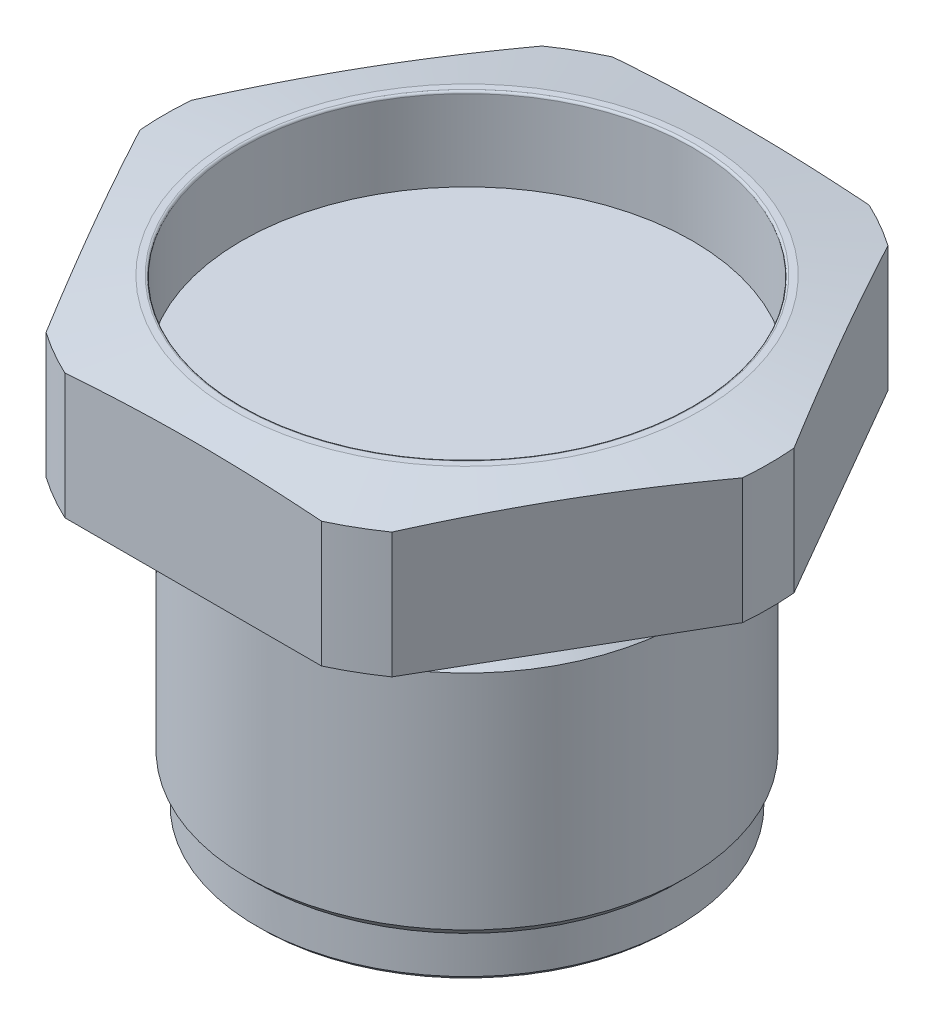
SolidWorks part; units mm, degrees
ref_plane "Front Plane" through (0, 0, 0) normal (0, 0, 1) x (1, 0, 0)
ref_plane "Top Plane" through (0, 0, 0) normal (0, 1, 0) x (1, 0, 0)
ref_plane "Right Plane" through (0, 0, 0) normal (1, 0, 0) x (0, 0, -1)
sketch "Sketch6" plane through (0, 0, 0) normal (0, 0, 1) x (1, 0, 0)
  line L0 (0, -8.9689) -> (0, 71.3762) construction
  line L1 (26.035, 15.875) -> (27.051, 15.875)
  line L2 (27.051, 15.875) -> (34.925, 14.4866)
  line L3 (34.925, 14.4866) -> (34.925, 0)
  line L4 (34.925, 0) -> (24.257, 0)
  line L5 (24.257, 0) -> (24.257, -37.6428)
  line L6 (24.257, -37.6428) -> (0, -37.6428)
  line L7 (0, -37.6428) -> (0, 6.2992)
  line L8 (26.035, 15.875) -> (26.035, 6.2992)
  line L9 (26.035, 6.2992) -> (0, 6.2992)
  dimension "D1" = 48.514
  dimension "D2" = 15.875
  dimension "D3" = 37.6428
  dimension "D4" = 69.85
  dimension "D5" = 10
  dimension "D6" = 54.102
  dimension "D7" = 9.5758
  dimension "D8" = 52.07
  dimension "D9" = 53.5178
revolve "Revolve3" add sketch "Sketch6" angle 360 about L0
fillet "Fillet7" radius 0.25 1 edges at (0, 15.875, -26.035)
sketch "Sketch7" plane through (0, 0, 0) normal (0, -1, 0) x (1, 0, 0)
  line L0 (0, 0) -> (0, -52.3237) construction
  line L1 (-18.2575, 31.623) -> (18.2575, 31.623)
  line L2 (18.2575, 31.623) -> (36.5151, 0)
  line L3 (36.5151, 0) -> (18.2575, -31.623)
  line L4 (18.2575, -31.623) -> (-18.2575, -31.623)
  line L5 (-18.2575, -31.623) -> (-36.5151, 0)
  line L6 (-36.5151, 0) -> (-18.2575, 31.623)
  circle A0 centre (0, 0) radius 36.5151 construction
  dimension "D1" = 63.246
extrude "Cut-Extrude5" cut sketch "Sketch7" against normal through all flip side to cut
chamfer "Chamfer2" distance 0.5 angle 45 1 edges at (0, -37.6428, -24.257)
sketch "Sketch8" plane through (0, 0, 0) normal (0, 0, 1) x (1, 0, 0)
  line L0 (-24.257, -4.826) -> (-24.257, -32.8168)
  line L1 (-24.257, 0) -> (-24.257, -37.1428) construction
  line L2 (-24.257, -32.8168) -> (-25.4, -31.6738)
  line L3 (-25.4, -31.6738) -> (-25.4, -5.969)
  line L4 (-25.4, -5.969) -> (-24.257, -4.826)
  line L5 (0, 0) -> (0, -37.1428) construction
  line L6 (-24.257, -37.1428) -> (24.257, -37.1428) construction
  line L7 (-23.757, -37.6428) -> (23.757, -37.6428) construction
  line L9 (-19.9745, 0) -> (-34.7982, 0) construction
  dimension "D1" = 45
  dimension "D2" = 50.8
  dimension "D3" = 4.826
  dimension "D4" = 4.826
revolve "Revolve4" add sketch "Sketch8" angle 360 about L5
fillet "Fillet8" radius 0.508 1 edges at (0, 0, -24.257)
sketch "Sketch9" plane through (0, 0, 0) normal (0, 0, 1) x (1, 0, 0)
  line L0 (0, 0) -> (0, -37.6428) construction
  line L1 (-23.757, -37.6428) -> (23.757, -37.6428) construction
  line L2 (0, -37.6428) -> (0, -36.2712)
  line L3 (0, -36.2712) -> (9.0043, -36.2712)
  line L4 (9.0043, -36.2712) -> (9.0043, -37.6428)
  line L5 (9.0043, -37.6428) -> (0, -37.6428)
  line L6 (10.9728, -37.6428) -> (10.9728, -37.1602)
  line L7 (11.1152, -37.6428) -> (10.9728, -37.6428)
  line L8 (12.7508, -37.1602) -> (12.7508, -37.6428)
  line L9 (12.7508, -37.6428) -> (12.6084, -37.6428)
  line L10 (15.7226, -36.2712) -> (21.3868, -36.2712)
  line L12 (20.6402, -37.6428) -> (14.351, -37.6428)
  arc A0 (15.7226, -36.2712) -> (14.351, -37.6428) centre (15.7226, -37.6428) ccw
  arc A1 (21.3868, -36.2712) -> (20.6402, -37.6428) centre (21.3868, -37.1602) ccw
  arc A2 (10.9728, -37.1602) -> (11.1152, -37.6428) centre (11.8618, -37.1602) ccw
  arc A3 (12.6084, -37.6428) -> (12.7508, -37.1602) centre (11.8618, -37.1602) ccw
  point P14 (15.7226, -36.2712)
  dimension "D2" = 1.778
  dimension "D1" = 0.4826
  dimension "D3" = 42.7736
  dimension "D4" = 28.702
  dimension "D5" = 18.0086
  dimension "D6" = 23.7236
revolve "Cut-Revolve1" cut sketch "Sketch9" angle 360 about L0
sketch "Sketch10" plane through (0, 0, 0) normal (0, 0, 1) x (1, 0, 0)
  line L0 (-22.1564, -37.6053) -> (-20.6172, -37.6053)
  line L2 (-12.6314, -37.6053) -> (-11.0922, -37.6053)
  line L3 (0, 0) -> (0, -34.798) construction
  arc A0 (-20.6402, -37.6428) -> (-21.3868, -36.2712) centre (-21.3868, -37.1602) ccw construction
  arc A1 (-22.1564, -37.6053) -> (-20.6172, -37.6053) centre (-21.3868, -37.1602) ccw
  arc A2 (-12.7508, -37.1602) -> (-12.6084, -37.6428) centre (-11.8618, -37.1602) ccw construction
  arc A5 (-12.6314, -37.6053) -> (-11.0922, -37.6053) centre (-11.8618, -37.1602) ccw
revolve "Revolve6" add sketch "Sketch10" angle 360 about L3
